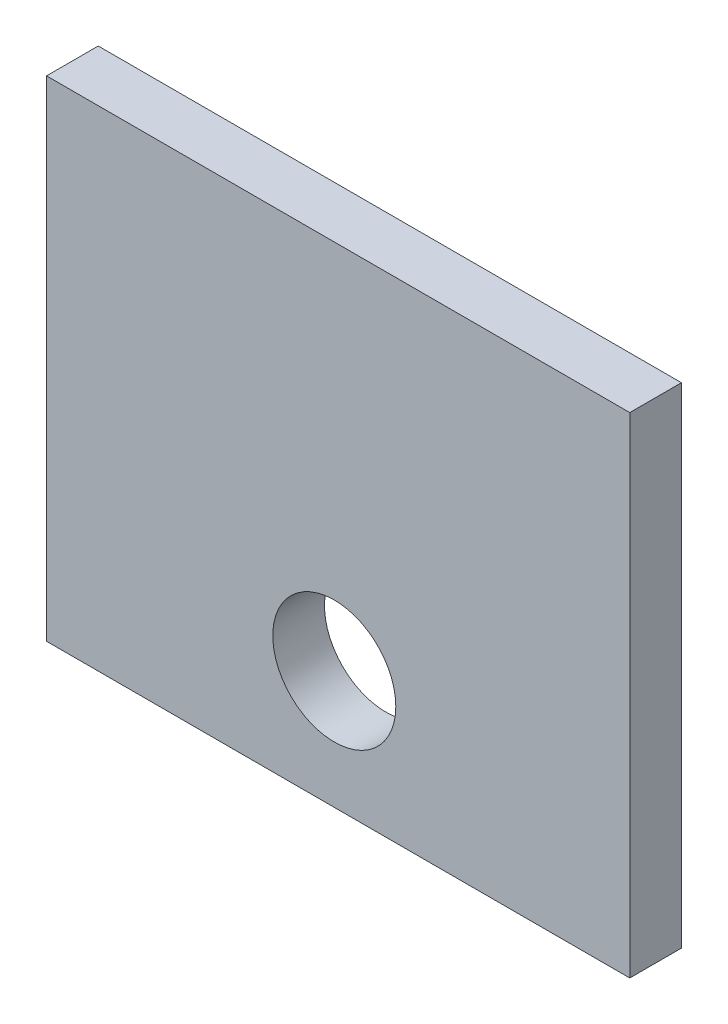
SolidWorks part; units mm, degrees
ref_plane "Front Plane" through (0, 0, 0) normal (0, 0, 1) x (1, 0, 0)
ref_plane "Top Plane" through (0, 0, 0) normal (0, 1, 0) x (1, 0, 0)
ref_plane "Right Plane" through (0, 0, 0) normal (1, 0, 0) x (0, 0, -1)
sketch "Sketch1" plane through (0, 0, 0) normal (0, 0, 1) x (1, 0, 0)
  line L0 (-14.5003, -8.2924) -> (-26.8203, -8.2924) construction
  line L1 (20.026, -19.7169) -> (-36.38, -19.7169)
  line L2 (-36.38, -19.7169) -> (-36.38, 27.6431)
  line L3 (-36.38, 27.6431) -> (20.026, 27.6431)
  line L4 (20.026, 27.6431) -> (20.026, -19.7169)
  line L5 (-2.6003, -8.2924) -> (9.7197, -8.2924) construction
  line L6 (-8.5503, 17.5076) -> (-8.5503, -19.4924) construction
  line L7 (-8.5503, -14.2424) -> (9.7197, -14.2424) construction
  circle A2 centre (-8.5503, -8.2924) radius 5.95
  dimension "D1" = 12.32
  dimension "D2" = 12.32
  dimension "D3" = 11.9
  dimension "D4" = 37
  dimension "D6" = 5.25
extrude "Boss-Extrude1" add sketch "Sketch1" along normal blind 5
